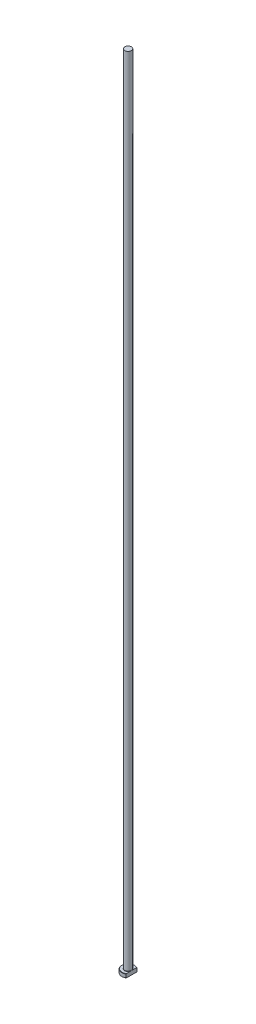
SolidWorks part; units mm, degrees
ref_plane "Front Plane" through (0, 0, 0) normal (0, 0, 1) x (1, 0, 0)
ref_plane "Top Plane" through (0, 0, 0) normal (0, 1, 0) x (1, 0, 0)
ref_plane "Right Plane" through (0, 0, 0) normal (1, 0, 0) x (0, 0, -1)
sketch "Sketch1" plane through (0, 0, 0) normal (0, 0, 1) x (1, 0, 0)
  line L0 (0, 259.9588) -> (0, -15.1925) construction
  line L1 (0, 0) -> (-5, 0)
  line L2 (-5, 0) -> (-5, 3)
  line L3 (-5, 3) -> (-2.6, 3)
  line L4 (-2.6, 3) -> (-2.6, 630)
  line L5 (-2.6, 630) -> (0, 630)
  line L6 (0, 630) -> (0, 0)
  dimension "L" = 630
  dimension "H" = 10
  dimension "T" = 3
  dimension "D" = 5.2
revolve "Revolve1" add sketch "Sketch1" angle 360 about L0
chamfer "Chamfer1" distance 0.2 angle 45 2 edges at (0, 3, 5) (0, 0, 5)
fillet "Fillet1" radius 0.2 1 edges at (0, 3, 2.6)
sketch "Sketch2" plane through (0, 0, 0) normal (0, 1, 0) x (1, 0, 0)
  line L0 (2.6, 4.2708) -> (2.6, -4.2708)
  circle A0 centre (0, 0) radius 5 construction
  arc A1 (2.6, -4.2708) -> (2.6, 4.2708) centre (0, 0) ccw
  circle A2 centre (0, 0) radius 2.6 construction
extrude "KEY" cut sketch "Sketch2" along normal through all
